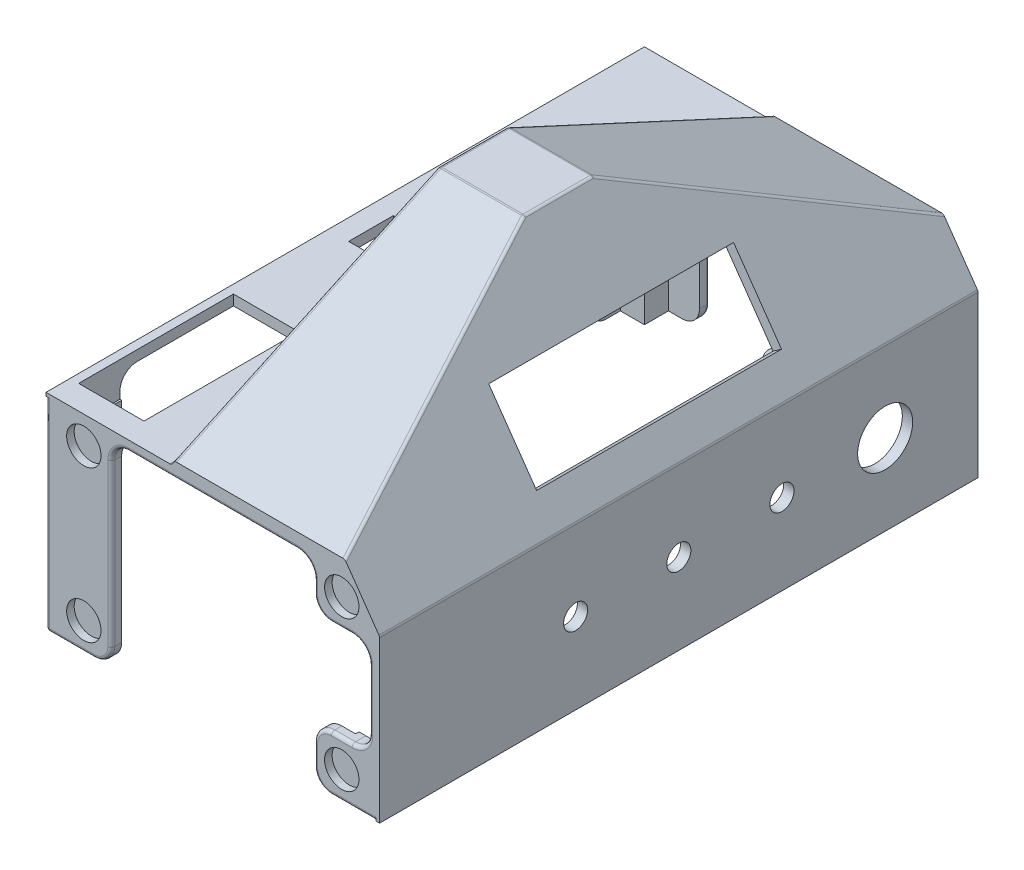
SolidWorks part; units mm, degrees
ref_plane "Ebene vorne" through (0, 0, 0) normal (0, 0, 1) x (1, 0, 0)
ref_plane "Ebene oben" through (0, 0, 0) normal (0, 1, 0) x (1, 0, 0)
ref_plane "Ebene rechts" through (0, 0, 0) normal (1, 0, 0) x (0, 0, -1)
sketch "Skizze1" plane through (0, 0, 0) normal (0, 0, 1) x (1, 0, 0)
  line L0 (0, 0) -> (0, 60)
  line L1 (0, 60) -> (40, 60)
  line L2 (40, 60) -> (40, 97)
  line L3 (40, 97) -> (64.9896, 97)
  line L4 (64.9896, 97) -> (100, 47)
  line L5 (100, 47) -> (100, 0)
  line L6 (100, 0) -> (0, 0)
  dimension "D1" = 100
  dimension "D2" = 60
  dimension "D3" = 40
  dimension "D4" = 97
  dimension "D5" = 55
  dimension "D6" = 47
extrude "Aufsatz-Linear austragen1" add sketch "Skizze1" against normal blind 180
sketch "Skizze2" plane through (100, 0, 0) normal (1, 0, 0) x (0, 0, -1)
  line L0 (0, 60) -> (80, 97)
  line L1 (0, 47) -> (0, 97) construction
  line L2 (180, 97) -> (0, 97) construction
  line L3 (80, 97) -> (0, 97)
  line L4 (0, 97) -> (0, 60)
  line L5 (90, 97) -> (90, 0) construction
  line L6 (180, 0) -> (0, 0) construction
  line L7 (100, 97) -> (180, 97)
  line L8 (180, 60) -> (100, 97)
  line L9 (180, 97) -> (180, 60)
  dimension "D1" = 80
  dimension "D2" = 60
extrude "Schnitt-Linear austragen2" cut sketch "Skizze2" against normal blind 139 contours L9 L7 L8 | L3 L4 L0
shell "Wandung1" thickness 3
sketch "Skizze3" plane through (89.1838, 62.4472, 0) normal (0.8192, 0.5736, 0) x (0, 0, -1)
  line L0 (90, 15.4425) -> (90, -8.8575) construction
  line L1 (54.4, 15.4425) -> (125.6, 15.4425)
  line L2 (54.4, 15.4425) -> (54.4, -8.8575)
  line L3 (54.4, -8.8575) -> (125.6, -8.8575)
  line L4 (125.6, 15.4425) -> (125.6, -8.8575)
  line L5 (90, -18.8575) -> (90, 42.1812) construction
  line L6 (180, -18.8575) -> (0, -18.8575) construction
  line L7 (100, 42.1812) -> (80, 42.1812) construction
  dimension "D1" = 71.2
  dimension "D2" = 24.3
  dimension "D3" = 10
extrude "Schnitt-Linear austragen3" cut sketch "Skizze3" against normal blind 10
sketch "Skizze4" plane through (86.7263, 60.7264, 0) normal (-0.8192, -0.5736, 0) x (0, 0, 1)
  line L0 (-127.3, 19.2425) -> (-52.3, -11.7575) construction
  line L1 (-127.3, 19.2425) -> (-52.3, 19.2425) construction
  line L2 (-127.3, 19.2425) -> (-127.3, -11.7575) construction
  line L3 (-127.3, -11.7575) -> (-52.3, -11.7575) construction
  line L4 (-52.3, 19.2425) -> (-52.3, -11.7575) construction
  line L5 (-125.6, -8.8575) -> (-54.4, 15.4425) construction
  line L6 (-125.6, -8.8575) -> (-125.6, 15.4425) construction
  line L7 (-125.6, 15.4425) -> (-54.4, 15.4425) construction
  line L8 (-54.4, 15.4425) -> (-54.4, -8.8575) construction
  circle A0 centre (-127.3, 19.2425) radius 1.25
  circle A1 centre (-52.3, 19.2425) radius 1.25
  circle A2 centre (-52.3, -11.7575) radius 1.25
  circle A3 centre (-127.3, -11.7575) radius 1.25
  circle A4 centre (-127.3, 19.2425) radius 3
  circle A5 centre (-52.3, 19.2425) radius 3
  circle A6 centre (-52.3, -11.7575) radius 3
  circle A7 centre (-127.3, -11.7575) radius 3
  dimension "D3" = 2.5
  dimension "D4" = 2.5
  dimension "D5" = 2.5
  dimension "D6" = 2.5
  dimension "D7" = 6
  dimension "D8" = 6
  dimension "D9" = 6
  dimension "D10" = 6
  dimension "D1" = 75
  dimension "D2" = 31
  dimension "D11" = 1.7
  dimension "D12" = 3.8
extrude "Aufsatz-Linear austragen2" add sketch "Skizze4" along normal blind 3.7
sketch "Skizze5" plane through (100, 0, 0) normal (1, 0, 0) x (0, 0, -1)
  line L0 (0, 23.5) -> (180, 23.5) construction
  line L1 (0, 0) -> (0, 47) construction
  line L2 (180, 0) -> (180, 47) construction
  circle A0 centre (90, 23.5) radius 3.5
  circle A1 centre (120, 23.5) radius 3.5
  circle A2 centre (60, 23.5) radius 3.5
  circle A3 centre (150, 23.5) radius 8
  dimension "D1" = 7
  dimension "D2" = 7
  dimension "D3" = 7
  dimension "D6" = 16
  dimension "D4" = 30
  dimension "D5" = 30
  dimension "D7" = 30
extrude "Schnitt-Linear austragen4" cut sketch "Skizze5" against normal blind 4.2
sketch "Skizze6" plane through (0, 60, 0) normal (0, 1, 0) x (1, 0, 0)
  line L0 (14, 50) -> (14, 10) construction
  line L1 (11.5, 10) -> (16.5, 10)
  line L2 (11.5, 10) -> (11.5, 50)
  line L3 (11.5, 50) -> (16.5, 50)
  line L4 (16.5, 10) -> (16.5, 50)
  line L5 (0, 180) -> (0, 0) construction
  line L7 (40, 180) -> (0, 180) construction
  line L8 (9, 85) -> (19, 85)
  line L9 (9, 85) -> (9, 95)
  line L10 (9, 95) -> (19, 95)
  line L11 (19, 85) -> (19, 95)
  line L12 (9, 85) -> (19, 95) construction
  line L13 (9, 95) -> (19, 85) construction
  line L14 (90.8973, 0) -> (40, 0) construction
  point P10 (14, 90)
  dimension "D1" = 5
  dimension "D2" = 14
  dimension "D3" = 10
  dimension "D4" = 50
  dimension "D5" = 10
  dimension "D6" = 10
  dimension "D7" = 14
  dimension "D8" = 90
extrude "Schnitt-Linear austragen5" cut sketch "Skizze6" against normal blind 4.2
sketch "Skizze7" plane through (0, 97, 0) normal (0, 1, 0) x (1, 0, 0)
  line L0 (100, 180) -> (0, 180)
  line L1 (0, 180) -> (0, 0)
  line L2 (0, 0) -> (100, 0)
  line L3 (100, 0) -> (100, 3)
  line L4 (100, 180) -> (100, 0) construction
  line L5 (100, 3) -> (3, 3)
  line L6 (3, 3) -> (3, 177)
  line L7 (3, 177) -> (100, 177)
  line L8 (100, 177) -> (100, 180)
  dimension "D1" = 3
  dimension "D2" = 3
  dimension "D3" = 3
extrude "Schnitt-Linear austragen6" cut sketch "Skizze7" against normal blind 121
sketch "Skizze8" plane through (0, 57, 0) normal (0, -1, 0) x (1, 0, 0)
  line L5 (43, -177) -> (89.9258, -177)
  line L6 (89.9258, -177) -> (89.9258, -173)
  line L7 (89.9258, -173) -> (43, -173)
  line L8 (43, -177) -> (43, -3) construction
  line L9 (43, -173) -> (43, -177)
  dimension "D1" = 4
extrude "Aufsatz-Linear austragen3" add sketch "Skizze8" against normal up to surface (2.9322 mm away)
sketch "Skizze9" plane through (0, 57, 0) normal (0, -1, 0) x (1, 0, 0)
  line L0 (43, -3) -> (89.9258, -3)
  line L1 (89.9258, -3) -> (89.9258, -7)
  line L2 (89.9258, -7) -> (43, -7)
  line L3 (43, -80.6602) -> (43, -3) construction
  line L4 (43, -7) -> (43, -3)
  dimension "D1" = 4
extrude "Aufsatz-Linear austragen4" add sketch "Skizze9" against normal up to surface (2.9322 mm away)
sketch "Skizze10" plane through (0, 57, 0) normal (0, -1, 0) x (1, 0, 0)
  line L0 (3, -3) -> (3, -22)
  line L1 (3, -177) -> (3, -3) construction
  line L2 (3, -22) -> (6, -22)
  line L3 (6, -22) -> (6, -6)
  line L4 (6, -6) -> (22, -6)
  line L5 (22, -6) -> (22, -3)
  line L6 (3, -3) -> (3, -0.6602) construction
  line L7 (22, -3) -> (3, -3)
  line L8 (3, -90) -> (100, -90) construction
  line L9 (100, -177) -> (100, -3) construction
  line L10 (22, -174) -> (22, -177)
  line L11 (6, -174) -> (22, -174)
  line L12 (6, -158) -> (6, -174)
  line L13 (3, -158) -> (6, -158)
  line L14 (3, -177) -> (3, -158)
  line L15 (22, -177) -> (3, -177)
  line L16 (88.5779, -3) -> (3, -3) construction
  dimension "D1" = 19
  dimension "D2" = 19
  dimension "D3" = 3
  dimension "D4" = 3
extrude "Aufsatz-Linear austragen5" add sketch "Skizze10" along normal up to surface (57 mm away)
sketch "Skizze11" plane through (0, 0, -177) normal (0, 0, -1) x (-1, 0, 0)
  line L0 (-100, 43.4975) -> (-81, 43.4975)
  line L1 (-97, 0) -> (-81, 0)
  line L2 (-97, 0) -> (-97, 16)
  line L3 (-97, 16) -> (-81, 16)
  line L4 (-81, 0) -> (-81, 16)
  line L5 (-100, 0) -> (-100, 47) construction
  line L6 (-81, 43.4975) -> (-81, 61.3875)
  line L7 (-40, 61.3875) -> (-89.9258, 61.3875) construction
  line L8 (-81, 61.3875) -> (-89.9258, 61.3875)
  line L9 (-89.9258, 61.3875) -> (-100, 47)
  line L10 (-100, 47) -> (-100, 43.4975)
  circle A0 centre (-89, 51.4975) radius 5 construction
  dimension "D3" = 10
  dimension "D5" = 8
  dimension "D6" = 8
  dimension "D1" = 16
  dimension "D2" = 16
  dimension "D4" = 19
  dimension "D7" = 17.89
extrude "Aufsatz-Linear austragen6" add sketch "Skizze11" against normal blind 3
sketch "Skizze12" plane through (0, 0, -177) normal (0, 0, -1) x (-1, 0, 0)
  line L0 (-22, 0) -> (-22, 57) construction
  line L1 (-3, 0) -> (-22, 0) construction
  line L2 (-3, 60) -> (-40, 60) construction
  line L3 (-81, 0) -> (-81, 16) construction
  line L4 (-97, 0) -> (-81, 0) construction
  circle A0 centre (-89, 51.4975) radius 5
  circle A1 centre (-14, 52) radius 5
  circle A2 centre (-14, 8) radius 5
  circle A3 centre (-89, 8) radius 5
  dimension "D1" = 10
  dimension "D2" = 10
  dimension "D3" = 10
  dimension "D4" = 10
  dimension "D5" = 8
  dimension "D6" = 8
  dimension "D7" = 8
  dimension "D8" = 8
  dimension "D9" = 8
  dimension "D10" = 8
extrude "Schnitt-Linear austragen7" cut sketch "Skizze12" against normal blind 2.2
sketch "Skizze13" plane through (0, 0, -3) normal (0, 0, 1) x (1, 0, 0)
  line L5 (81, 0) -> (97, 0)
  line L6 (97, 0) -> (97, 16)
  line L7 (97, 16) -> (81, 16)
  line L8 (81, 16) -> (81, 0)
  line L9 (81, 43.4975) -> (81, 61.3875)
  line L10 (40, 61.3875) -> (89.9258, 61.3875) construction
  line L11 (81, 61.3875) -> (89.9258, 61.3875)
  line L12 (89.9258, 61.3875) -> (100, 47)
  line L13 (100, 47) -> (100, 43.4975)
  line L14 (100, 0) -> (100, 47) construction
  line L15 (100, 43.4975) -> (81, 43.4975)
extrude "Aufsatz-Linear austragen7" add sketch "Skizze13" against normal blind 3
sketch "Skizze14" plane through (0, 0, -3) normal (0, 0, 1) x (1, 0, 0)
  circle A0 centre (14, 52) radius 5
  circle A1 centre (89, 51.4975) radius 5
  circle A2 centre (89, 8) radius 5
  circle A3 centre (14, 8) radius 5
  dimension "D1" = 10
  dimension "D2" = 10
  dimension "D3" = 10
  dimension "D4" = 10
extrude "Schnitt-Linear austragen8" cut sketch "Skizze14" against normal blind 2.2
sketch "Skizze15" plane through (3, 0, 0) normal (-1, 0, 0) x (0, 0, 1)
  line L1 (-158, 0) -> (-158, 57) construction
  line L2 (-177, 60) -> (-3, 60) construction
  line L3 (-158, 0) -> (-177, 0) construction
  line L4 (-3, 0) -> (-22, 0) construction
  line L7 (-22, 0) -> (-22, 57) construction
  circle A0 centre (-166, 52) radius 5
  circle A1 centre (-166, 8) radius 5
  circle A2 centre (-14, 8) radius 5
  circle A3 centre (-14, 52) radius 5
  dimension "D1" = 10
  dimension "D2" = 10
  dimension "D3" = 10
  dimension "D4" = 10
  dimension "D12" = 8
  dimension "D5" = 8
  dimension "D6" = 8
  dimension "D7" = 8
  dimension "D8" = 8
  dimension "D9" = 8
  dimension "D10" = 8
  dimension "D11" = 8
extrude "Schnitt-Linear austragen9" cut sketch "Skizze15" against normal blind 2.2
fillet "Verrundung1" radius 5 20 edges at (4.5, 57, -22) (22, 57, -4.5) (22, 0, -4.5) (4.5, 0, -22) (4.5, 57, -158) (22, 57, -175.5) (22, 0, -175.5) (4.5, 0, -158) (97, 16, -175.5) (81, 16, -175.5) (81, 0, -175.5) (81, 43.4975, -175.5) (81, 57, -175.5) (97, 43.4975, -175.5) (81, 43.4975, -4.5) (97, 43.4975, -4.5) (81, 57, -4.5) (81, 0, -4.5) (81, 16, -4.5) (97, 16, -4.5)
sketch "Skizze16" plane through (0, 0, 0) normal (0, -1, 0) x (1, 0, 0)
  line L0 (100, -90) -> (3, -90) construction
  line L1 (6, -6) -> (13, -6)
  line L2 (6, -6) -> (6, -13)
  line L3 (6, -13) -> (13, -13)
  line L4 (13, -6) -> (13, -13)
  line L5 (97, -6) -> (90, -6)
  line L6 (97, -6) -> (97, -13)
  line L7 (97, -13) -> (90, -13)
  line L8 (90, -6) -> (90, -13)
  line L9 (100, -177) -> (100, -3) construction
  line L10 (3, -153) -> (3, -27) construction
  line L11 (97, -167) -> (90, -167)
  line L12 (90, -174) -> (90, -167)
  line L13 (97, -174) -> (90, -174)
  line L14 (97, -174) -> (97, -167)
  line L15 (6, -167) -> (13, -167)
  line L16 (13, -174) -> (13, -167)
  line L17 (6, -174) -> (13, -174)
  line L18 (6, -174) -> (6, -167)
  line L19 (6, -27) -> (6, -6) construction
  line L20 (6, -6) -> (17, -6) construction
  dimension "D1" = 7
  dimension "D2" = 7
  dimension "D3" = 7
  dimension "D4" = 7
extrude "Aufsatz-Linear austragen9" add sketch "Skizze16" against normal blind 10
sketch "Skizze17" plane through (0, 0, 0) normal (0, -1, 0) x (1, 0, 0)
  line L0 (6, -6) -> (13, -13) construction
  line L1 (97, -6) -> (90, -13) construction
  line L2 (100, -90) -> (3, -90) construction
  circle A0 centre (9.5, -9.5) radius 1.25
  circle A1 centre (93.5, -9.5) radius 1.25
  circle A2 centre (93.5, -170.5) radius 1.25
  circle A3 centre (9.5, -170.5) radius 1.25
  dimension "D1" = 2.5
  dimension "D2" = 2.5
extrude "Schnitt-Linear austragen10" cut sketch "Skizze17" against normal blind 8
chamfer "Fase2" distance 7 angle 45 8 edges at (6, 10, -170.5) (9.5, 10, -174) (9.5, 10, -6) (6, 10, -9.5) (97, 10, -9.5) (93.5, 10, -6) (93.5, 10, -174) (97, 10, -170.5)
sketch "Skizze18" plane through (3, 0, 0) normal (-1, 0, 0) x (0, 0, 1)
  line L0 (-22, 28.5) -> (-3, 28.5) construction
  line L1 (-22, 5) -> (-22, 52) construction
  line L2 (-3, 0) -> (-3, 60) construction
  line L4 (-7, 18.5) -> (-22, 18.5)
  line L5 (-7, 18.5) -> (-7, 38.5)
  line L6 (-7, 38.5) -> (-22, 38.5)
  line L7 (-22, 18.5) -> (-22, 38.5)
  line L8 (-7, 18.5) -> (-22, 38.5) construction
  line L9 (-7, 38.5) -> (-22, 18.5) construction
  point P6 (-14.5, 28.5)
  dimension "D1" = 20
  dimension "D2" = 15
extrude "Schnitt-Linear austragen11" cut sketch "Skizze18" against normal blind 8
fillet "Verrundung3" radius 5 4 edges at (4.5, 38.5, -22) (4.5, 38.5, -7) (4.5, 18.5, -7) (4.5, 18.5, -22)
fillet "Verrundung4" radius 1 53 edges at (93, 0, -177) (82.4645, 1.4645, -177) (81, 8, -177) (82.4645, 14.5355, -177) (89, 16, -177) (95.5355, 17.4645, -177) (97, 29.7488, -177) (95.5355, 42.033, -177) (89, 43.4975, -177) (82.4645, 44.962, -177) (81, 50.2488, -177) (79.5355, 55.5355, -177) (51.5, 57, -177) (23.4645, 55.5355, -177) (22, 28.5, -177) (20.5355, 1.4645, -177) (10, 0, -177) (93, 0, -3) (82.4645, 1.4645, -3) (81, 8, -3) (82.4645, 14.5355, -3) (89, 16, -3) (95.5355, 17.4645, -3) (97, 29.7488, -3) (95.5355, 42.033, -3) (89, 43.4975, -3) (82.4645, 44.962, -3) (81, 50.2488, -3) (79.5355, 55.5355, -3) (51.5, 57, -3) (23.4645, 55.5355, -3) (22, 28.5, -3) (20.5355, 1.4645, -3) (3, 0, -170) (3, 1.4645, -159.4645) (3, 0, -10) (3, 1.4645, -20.5355) (3, 9.25, -22) (3, 17.0355, -20.5355) (3, 18.5, -14.5) (3, 19.9645, -8.4645) (3, 28.5, -7) (3, 37.0355, -8.4645) (3, 38.5, -14.5) (3, 39.9645, -20.5355) (3, 47.75, -22) (3, 55.5355, -23.4645) (3, 57, -90) (3, 55.5355, -156.5355) (3, 30, -3) (10, 0, -3) (3, 28.5, -158) (3, 30, -177)
sketch "Skizze19" plane through (0, 60, 0) normal (0, 1, 0) x (1, 0, 0)
  line L0 (4.5, 3) -> (3, 3)
  line L1 (40, 3) -> (4, 3) construction
  line L2 (3, 4.5) -> (3, 3)
  line L3 (3, 4) -> (3, 176) construction
  line L4 (3, 4.5) -> (4.5, 3)
  line L5 (3, 90) -> (100, 90) construction
  line L6 (100, 177) -> (100, 3) construction
  line L7 (3, 175.5) -> (4.5, 177)
  line L8 (3, 175.5) -> (3, 177)
  line L9 (4.5, 177) -> (3, 177)
  dimension "D1" = 1.5
  dimension "D2" = 1.5
extrude "Aufsatz-Linear austragen10" add sketch "Skizze19" against normal blind 1
sketch "Skizze20" plane through (0, 60, 0) normal (0, 1, 0) x (1, 0, 0)
  line L1 (9, 95) -> (19, 95)
  line L2 (9, 95) -> (9, 98)
  line L3 (9, 98) -> (19, 98)
  line L4 (19, 95) -> (19, 98)
  dimension "D1" = 10
  dimension "D2" = 3
extrude "Schnitt-Linear austragen12" cut sketch "Skizze20" against normal blind 10
sketch "Skizze21" plane through (0, 57, 0) normal (0, -1, 0) x (1, 0, 0)
  line L5 (16.5, -50) -> (11.5, -50) construction
  line L6 (11.5, -10) -> (5.5, -10)
  line L7 (11.5, -10) -> (11.5, -50)
  line L8 (11.5, -50) -> (5.5, -50)
  line L9 (5.5, -10) -> (5.5, -50)
  dimension "D1" = 6
extrude "Schnitt-Linear austragen13" cut sketch "Skizze21" against normal blind 2
fillet "Verrundung6" radius 1 8 edges at (52.4948, 97, -80) (52.4948, 97, -100) (40, 97, -90) (40, 60, -90) (64.9896, 97, -90) (77.4577, 79.1938, -138.5) (77.4577, 79.1937, -41.5) (100, 47, -90)
fillet "Verrundung7" radius 1 4 edges at (40.7851, 96.9766, -99.9949) (40, 78.6938, -139.5811) (40.7851, 96.9766, -80.0051) (40, 78.6937, -40.4189)
sketch "Skizze22" plane through (100, 0, 0) normal (1, 0, 0) x (0, 0, -1)
  line L0 (4.5, 0) -> (3, 0)
  line L1 (176, 0) -> (4, 0) construction
  line L2 (3, 1.5) -> (3, 0)
  line L3 (3, 1) -> (3, 46.6847) construction
  line L4 (3, 1.5) -> (4.5, 0)
  line L5 (90, 0) -> (90, 96.5736) construction
  line L6 (99.7799, 96.5736) -> (80.2201, 96.5736) construction
  line L7 (177, 1.5) -> (175.5, 0)
  line L8 (177, 1.5) -> (177, 0)
  line L9 (175.5, 0) -> (177, 0)
  dimension "D1" = 1.5
  dimension "D2" = 1.5
extrude "Aufsatz-Linear austragen11" add sketch "Skizze22" against normal blind 1
sketch "Skizze23" plane through (86.7263, 60.7264, 0) normal (-0.8192, -0.5736, 0) x (0, 0, 1)
  circle A0 centre (-127.3, -11.7575) radius 1.25
  circle A1 centre (-127.3, 19.2425) radius 1.25
  circle A2 centre (-52.3, 19.2425) radius 1.25
  circle A3 centre (-52.3, -11.7575) radius 1.25
  dimension "D1" = 2.5
  dimension "D2" = 2.5
  dimension "D3" = 2.5
  dimension "D4" = 2.5
extrude "Schnitt-Linear austragen14" cut sketch "Skizze23" against normal blind 2.2
sketch "Skizze24" plane through (0, 60, 0) normal (0, 1, 0) x (1, 0, 0)
  line L0 (41, 175.8754) -> (41, 100.1997) construction
  line L1 (31, 44) -> (41, 44)
  line L2 (31, 44) -> (31, 139)
  line L3 (31, 139) -> (41, 139)
  line L4 (41, 44) -> (41, 139)
  line L5 (31, 44) -> (41, 139) construction
  line L6 (31, 139) -> (41, 44) construction
  line L7 (19, 85) -> (19, 98) construction
  point P0 (36, 91.5)
  point P10 (19, 91.5)
  dimension "D1" = 10
  dimension "D2" = 95
extrude "Aufsatz-Linear austragen12" add sketch "Skizze24" along normal blind 10
sketch "Skizze25" plane through (83.6955, 58.6042, 0) normal (-0.8192, -0.5736, 0) x (0, 0, 1)
  line L0 (-173, 22.0279) -> (-7, 22.0279) construction
  line L1 (-132.5, 22.0279) -> (-47.5, 22.0279)
  line L2 (-132.5, 22.0279) -> (-132.5, 24.2425)
  line L3 (-132.5, 24.2425) -> (-47.5, 24.2425)
  line L4 (-47.5, 22.0279) -> (-47.5, 24.2425)
  line L5 (-132.5, 22.0279) -> (-47.5, 24.2425) construction
  line L6 (-132.5, 24.2425) -> (-47.5, 22.0279) construction
  line L7 (-125.6, 15.4425) -> (-54.4, 15.4425) construction
  line L8 (-132.5, 24.2425) -> (-134.7146, 22.0279)
  line L9 (-134.7146, 22.0279) -> (-132.5, 22.0279)
  line L10 (-47.5, 24.2425) -> (-45.2854, 22.0279)
  line L11 (-45.2854, 22.0279) -> (-47.5, 22.0279)
  line L12 (-132.5, 24.2425) -> (-132.5, 22.0279)
  line L13 (-47.5, 22.0279) -> (-47.5, 24.2425)
  circle A0 centre (-127.3, 19.2425) radius 1.25 construction
  point P0 (-90, 23.1352)
  point P9 (-90, 15.4425)
  dimension "D2" = 5
  dimension "D1" = 85
  dimension "D3" = 45
  dimension "D4" = 45
extrude "Schnitt-Linear austragen16" cut sketch "Skizze25" along normal blind 111 contours L3 L4 L1 L2
sketch "Skizze26" plane through (0, 115.2846, -53.3191) normal (0, -0.9076, 0.4198) x (1, 0, 0)
  line L0 (69.7905, -81.5141) -> (70.5374, -83.8991)
  line L1 (70.5374, -83.8991) -> (68.2673, -83.8991)
  line L2 (68.2673, -83.8991) -> (69.7905, -81.5141)
extrude "Aufsatz-Linear austragen14" add sketch "Skizze26" against normal blind 2
sketch "Skizze27" plane through (0, 46.7043, 21.6008) normal (0, -0.9076, -0.4198) x (1, 0, 0)
  line L0 (70.5374, -77.0978) -> (69.7905, -79.4828)
  line L1 (69.7905, -79.4828) -> (68.2673, -77.0978)
  line L2 (68.2673, -77.0978) -> (70.5374, -77.0978)
extrude "Aufsatz-Linear austragen15" add sketch "Skizze27" against normal blind 2
sketch "Skizze28" plane through (0, 0, -139) normal (0, 0, -1) x (-1, 0, 0)
  line L0 (-40, 70) -> (-31, 60)
  line L1 (-31, 60) -> (-31, 70)
  line L2 (-31, 70) -> (-40, 70)
extrude "Schnitt-Linear austragen17" cut sketch "Skizze28" against normal blind 118
fillet "Verrundung8" radius 1 10 edges at (39.7071, 60.2929, -44) (35, 60, -44) (40, 65.5, -44) (39.7071, 60.2929, -139) (40, 65.5, -139) (35, 60, -139) (35.5, 65, -44) (31, 60, -91.5) (35.5, 65, -139) (40, 70, -91.5)
sketch "Skizze29" plane through (0, 60, 0) normal (0, 1, 0) x (1, 0, 0)
  line L0 (11.5, 50) -> (16.5, 10) construction
  line L2 (9.5, 10) -> (18.5, 10)
  line L3 (9.5, 10) -> (9.5, 50)
  line L4 (9.5, 50) -> (18.5, 50)
  line L5 (18.5, 10) -> (18.5, 50)
  line L6 (9.5, 10) -> (18.5, 50) construction
  line L7 (9.5, 50) -> (18.5, 10) construction
  point P4 (14, 30)
  dimension "D1" = 40
  dimension "D2" = 9
extrude "Schnitt-Linear austragen18" cut sketch "Skizze29" against normal blind 10
sketch "Skizze30" plane through (97, 0, 0) normal (-1, 0, 0) x (0, 0, 1)
  line L0 (-56.5, 23.5) -> (-142, 23.5) construction
  line L1 (-95, 22) -> (-95, 25)
  line L2 (-65, 22) -> (-67, 22)
  line L3 (-65, 22) -> (-65, 25)
  line L4 (-65, 25) -> (-67, 25)
  line L5 (-67, 22) -> (-67, 25)
  line L6 (-65, 22) -> (-67, 25) construction
  line L7 (-65, 25) -> (-67, 22) construction
  line L8 (-95, 22) -> (-97, 22)
  line L9 (-97, 22) -> (-97, 25)
  line L10 (-95, 25) -> (-97, 25)
  line L11 (-125, 22) -> (-125, 25)
  line L12 (-125, 22) -> (-127, 22)
  line L13 (-127, 22) -> (-127, 25)
  line L14 (-125, 25) -> (-127, 25)
  circle A0 centre (-60, 23.5) radius 3.5 construction
  circle A1 centre (-150, 23.5) radius 8 construction
  point P7 (-66, 23.5)
  dimension "D1" = 2
  dimension "D2" = 3
  dimension "D3" = 6
  dimension "D5" = 30
  dimension "D4" = 3
extrude "Schnitt-Linear austragen19" cut sketch "Skizze30" against normal blind 1
sketch "Skizze31" plane through (0, 60, 0) normal (0, 1, 0) x (1, 0, 0)
  line L0 (9.5, 10) -> (18.5, 10) construction
  line L1 (18.5, 50) -> (24.5, 50)
  line L2 (18.5, 50) -> (18.5, 10)
  line L3 (18.5, 10) -> (24.5, 10)
  line L4 (24.5, 50) -> (24.5, 10)
  dimension "D1" = 6
extrude "Schnitt-Linear austragen20" cut sketch "Skizze31" against normal blind 10
sketch "Skizze32" plane through (0, 60, 0) normal (0, 1, 0) x (1, 0, 0)
  line L0 (24.5, 10) -> (24.5, 50) construction
  line L1 (9.5, 50) -> (24.5, 50)
  line L2 (9.5, 50) -> (9.5, 55)
  line L3 (9.5, 55) -> (24.5, 55)
  line L4 (24.5, 50) -> (24.5, 55)
  dimension "D1" = 5
extrude "Schnitt-Linear austragen21" cut sketch "Skizze32" against normal blind 10
sketch "Skizze33" plane through (0, 60, 0) normal (0, 1, 0) x (1, 0, 0)
  line L0 (9.5, 10) -> (24.5, 10) construction
  line L1 (9.5, 55) -> (5.5, 55)
  line L2 (9.5, 55) -> (9.5, 10)
  line L3 (9.5, 10) -> (5.5, 10)
  line L4 (5.5, 55) -> (5.5, 10)
  dimension "D1" = 4
extrude "Schnitt-Linear austragen22" cut sketch "Skizze33" against normal blind 10
